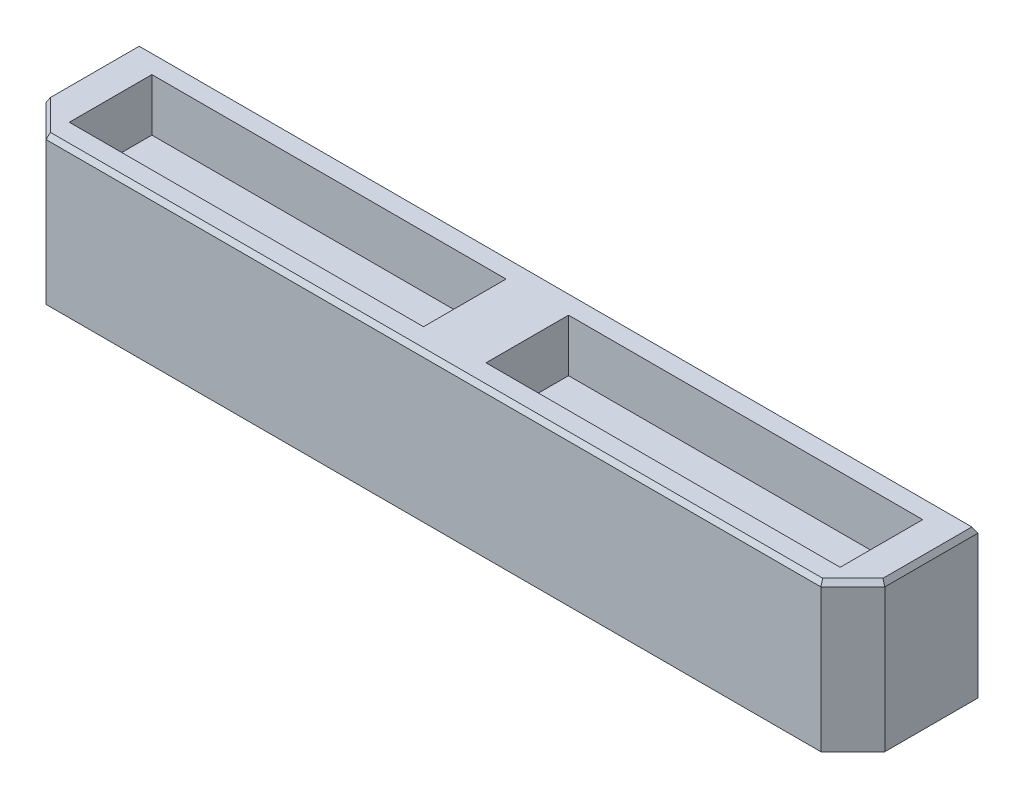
SolidWorks part; units mm, degrees
ref_plane "Plane1" through (0, 0, 0) normal (0, 0, 1) x (1, 0, 0)
ref_plane "Plane2" through (0, 0, 0) normal (0, 1, 0) x (1, 0, 0)
ref_plane "Plane3" through (0, 0, 0) normal (1, 0, 0) x (0, 0, -1)
ref_plane "Plane4" through (0, 0, 2.9845) normal (0, 0, 1) x (1, 0, 0)
sketch "Sketch1" plane through (0, 0, 2.9845) normal (0, 0, 1) x (1, 0, 0)
  line L0 (-20.0025, 0.2032) -> (17.7228, 0.2032)
  line L1 (17.7228, 0.2032) -> (17.7228, 7.2669)
  line L2 (17.7228, 7.2669) -> (-20.0025, 7.2669)
  line L3 (-20.0025, 7.2669) -> (-20.0025, 0.2032)
extrude "Extrude1" add sketch "Sketch1" against normal blind 5.969
sketch "Sketch2" plane through (0, 0, 2.9845) normal (0, 0, 1) x (1, 0, 0)
  line L0 (-2.2797, 0.381) -> (-2.2797, 0)
  line L1 (-2.2797, 0) -> (-17.7229, 0)
  line L2 (-17.7229, 0) -> (-17.7229, 0.381)
  line L3 (-17.7229, 0.381) -> (-2.2797, 0.381)
extrude "Extrude2" [suppressed] add sketch "Sketch2" along normal blind 0.5715
ref_plane "Plane5" through (17.7228, 0, 0) normal (1, 0, 0) x (0, 0, -1)
sketch "Sketch3" plane through (17.7228, 0, 0) normal (1, 0, 0) x (0, 0, -1)
  line L0 (-2.9845, 0.381) -> (-3.556, 0.381)
  line L1 (-3.556, 0.381) -> (-3.556, 0)
  line L2 (-3.556, 0) -> (-2.9845, 0)
  line L3 (-2.9845, 0) -> (-2.9845, 0.2032)
  line L4 (-2.9845, 0.2032) -> (-2.9845, 0.381)
extrude "Extrude3" [suppressed] add sketch "Sketch3" against normal blind 15.4432
sketch "Sketch4" plane through (17.7228, 0, 0) normal (1, 0, 0) x (0, 0, -1)
  line L0 (-2.9845, 7.2669) -> (2.9845, 7.2669)
  line L1 (2.9845, 7.2669) -> (2.9845, 0.2032)
  line L2 (2.9845, 0.2032) -> (-2.9845, 0.2032)
  line L3 (-2.9845, 0.2032) -> (-2.9845, 7.2669)
extrude "Extrude4" add sketch "Sketch4" along normal blind 2.2797
sketch "Sketch5" plane through (0, 0, -2.9845) normal (0, 0, -1) x (-1, 0, 0)
  line L0 (-17.7228, 0) -> (-17.7228, 0.381)
  line L1 (-17.7228, 0.381) -> (-2.2796, 0.381)
  line L2 (-2.2796, 0.381) -> (-2.2796, 0)
  line L3 (-2.2796, 0) -> (-17.7228, 0)
extrude "Extrude5" [suppressed] add sketch "Sketch5" along normal blind 0.5715
sketch "Sketch6" plane through (0, 0, -2.9845) normal (0, 0, -1) x (-1, 0, 0)
  line L0 (2.2797, 0) -> (2.2797, 0.381)
  line L1 (2.2797, 0.381) -> (17.7229, 0.381)
  line L2 (17.7229, 0.381) -> (17.7229, 0)
  line L3 (17.7229, 0) -> (2.2797, 0)
extrude "Extrude6" [suppressed] add sketch "Sketch6" along normal blind 0.5715
sketch "Sketch7" plane through (0, 7.2669, 0) normal (0, 1, 0) x (-1, 0, 0)
  line L0 (-18.3818, 1.9685) -> (-18.3818, -1.9685)
  line L1 (-18.3818, -1.9685) -> (-1.4908, -1.9685)
  line L2 (-1.4908, -1.9685) -> (-1.4908, 1.9685)
  line L3 (-1.4908, 1.9685) -> (-18.3818, 1.9685)
  line L4 (-1.4908, 0) -> (-7.7585, 0) construction
  line L5 (0, 0) -> (0, 6.755) construction
  line L6 (1.4908, 1.9685) -> (18.3818, 1.9685)
  line L7 (1.4908, -1.9685) -> (1.4908, 1.9685)
  line L8 (18.3818, -1.9685) -> (1.4908, -1.9685)
  line L9 (18.3818, 1.9685) -> (18.3818, -1.9685)
  dimension "D1" = 3.937
  dimension "D2" = 16.891
  dimension "D3" = 2.9815
extrude "Cut-Extrude1" cut sketch "Sketch7" against normal blind 2.5
chamfer "Chamfer1" distance 1.524 angle 45 1 edges at (-20.0025, 3.7351, 2.9845)
chamfer "Chamfer2" distance 1.524 angle 45 1 edges at (20.0025, 3.7351, 2.9845)
chamfer "Chamfer3" distance 0.147 angle 59.94 6 edges at (0, 7.2669, 2.9845) (19.2405, 7.2669, 2.2225) (-19.2405, 7.2669, 2.2225) (20.0025, 7.2669, -0.762) (-20.0025, 7.2669, -0.762) (0, 7.2669, -2.9845)
